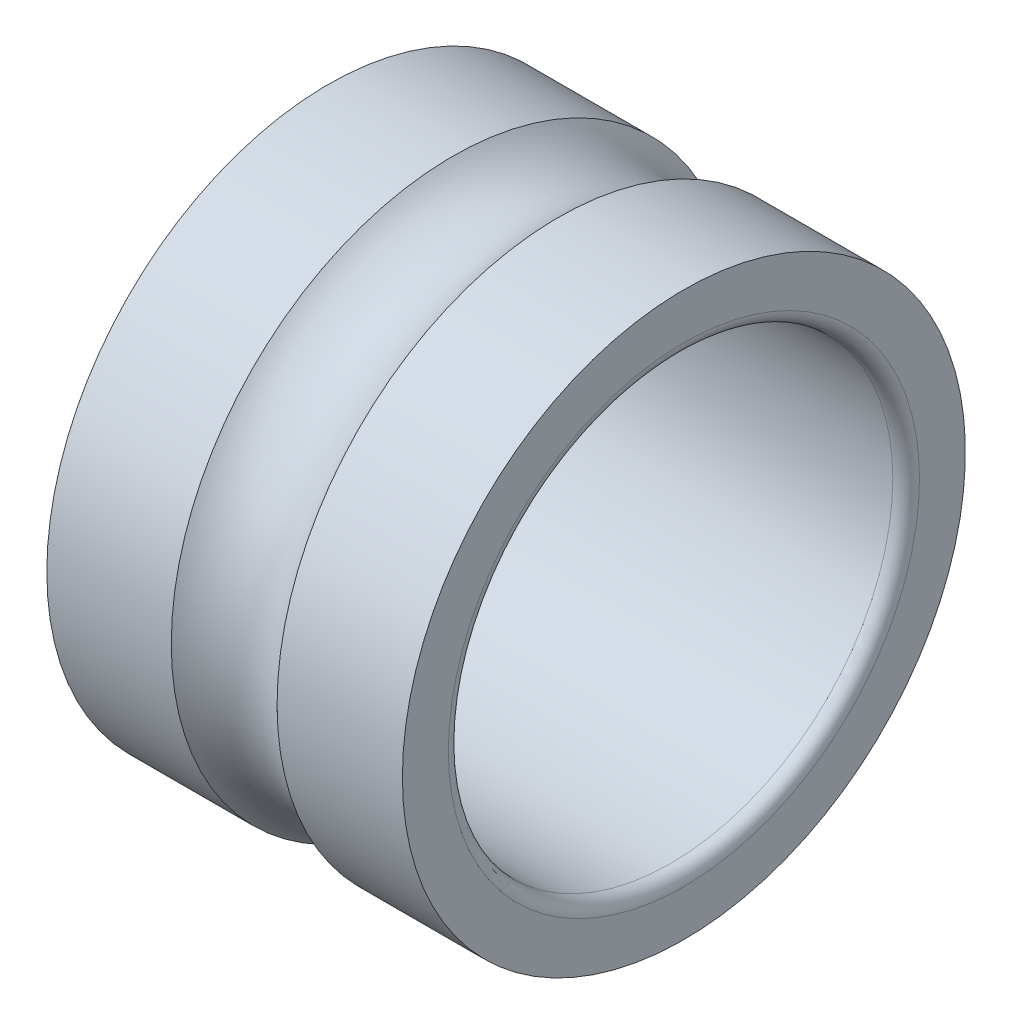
SolidWorks part; units mm, degrees
ref_plane "Ebene vorne" through (0, 0, 0) normal (0, 0, 1) x (1, 0, 0)
ref_plane "Ebene oben" through (0, 0, 0) normal (0, 1, 0) x (1, 0, 0)
ref_plane "Ebene rechts" through (0, 0, 0) normal (1, 0, 0) x (0, 0, -1)
ref_plane "Ebene1" through (0, 0, 0) normal (0, 0, -1) x (-1, 0, 0)
sketch "Skizze1" plane through (0, 0, 0) normal (0, 0, -1) x (-1, 0, 0)
  line L0 (-3.3549, 2.5) -> (0.3451, 2.5)
  line L1 (0.4951, 2.65) -> (0.4951, 3.1667)
  line L2 (0.4951, 3.1667) -> (-0.9049, 3.1667)
  line L3 (-2.0951, 3.1667) -> (-3.5049, 3.1667)
  line L4 (-3.5049, 3.1667) -> (-3.5049, 2.65)
  line L5 (-3, 0) -> (0, 0) construction
  arc A0 (0.3451, 2.5) -> (0.4951, 2.65) centre (0.3451, 2.65) ccw
  arc A1 (-0.9049, 3.1667) -> (-2.0951, 3.1667) centre (-1.5, 3.75) cw
  arc A2 (-3.5049, 2.65) -> (-3.3549, 2.5) centre (-3.3549, 2.65) ccw
revolve "Rotation1" add sketch "Skizze1" angle 360 about L5
